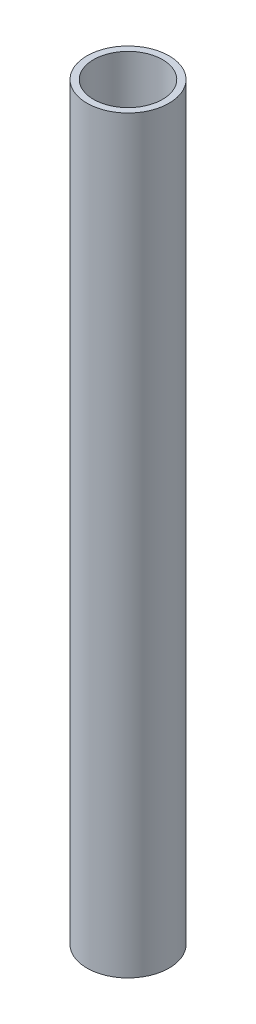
SolidWorks part; units mm, degrees
ref_plane "Front Plane" through (0, 0, 0) normal (0, 0, 1) x (1, 0, 0)
ref_plane "Top Plane" through (0, 0, 0) normal (0, 1, 0) x (1, 0, 0)
ref_plane "Right Plane" through (0, 0, 0) normal (1, 0, 0) x (0, 0, -1)
sketch "Sketch1" plane through (0, 0, 0) normal (0, 1, 0) x (1, 0, 0)
  circle A0 centre (0, 0) radius 10.5
  circle A1 centre (0, 0) radius 12.5
  dimension "D1" = 25
  dimension "D2" = 2
sketch "Sketch2" plane through (0, 0, 0) normal (1, 0, 0) x (0, 0, -1)
  line L0 (0, 0) -> (0, 228)
  point P3 (0, 0)
  point P4 (0, 0)
  dimension "D1" = 228
extrude "Boss-Extrude1" add sketch "Sketch1" along normal up to vertex (228 mm away)
